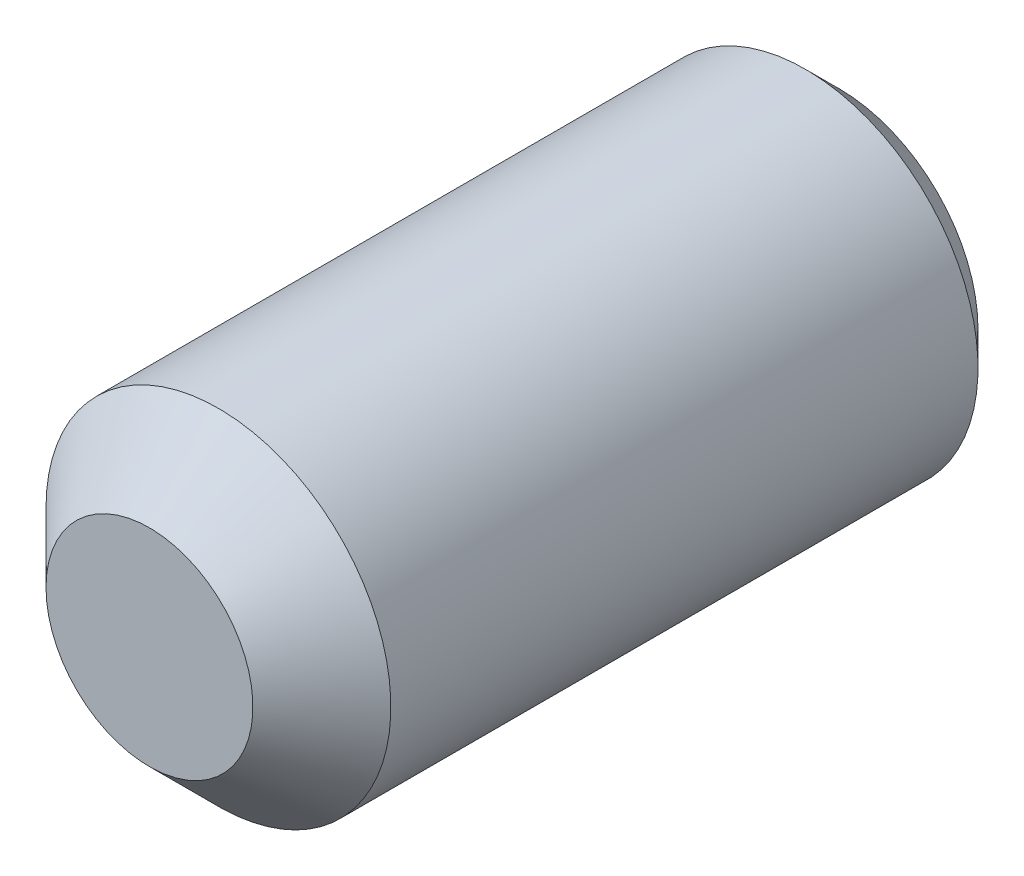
SolidWorks part; units mm, degrees
other "<hex socket set screws with flat point gb>-<Cut-Revolve1>"
ref_plane "前视基准面" through (0, 0, 0) normal (0, 0, 1) x (1, 0, 0)
ref_plane "上视基准面" through (0, 0, 0) normal (0, 1, 0) x (1, 0, 0)
ref_plane "右视基准面" through (0, 0, 0) normal (1, 0, 0) x (0, 0, -1)
inserted part "hex socket set screws with flat point gb"
move or copy body "实体-移动/复制2" placed by mates yes
